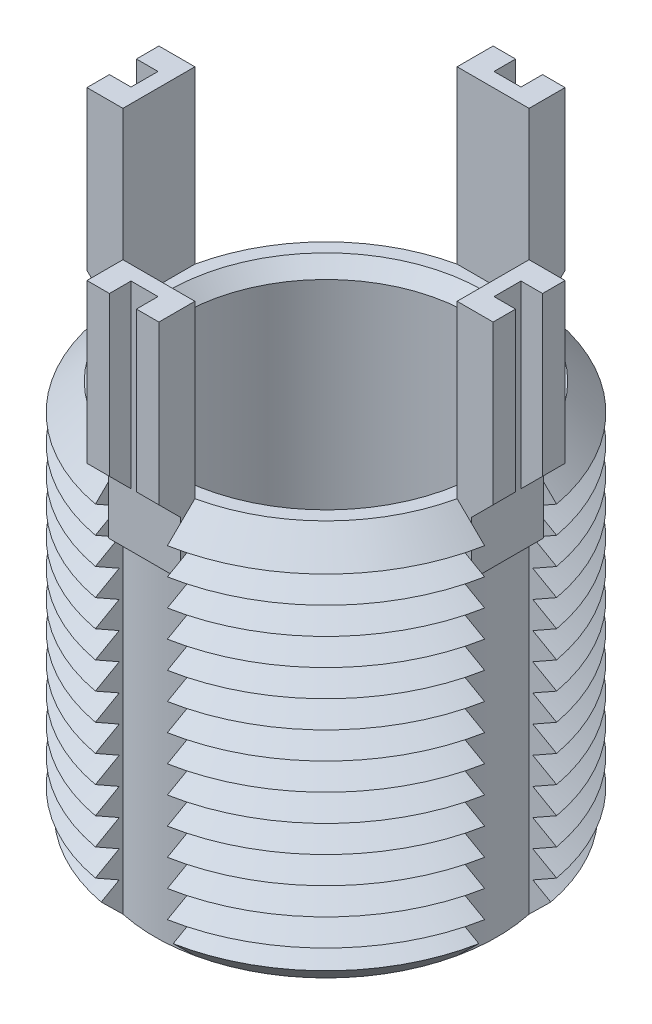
SolidWorks part; units mm, degrees
ref_plane "Front Plane" through (0, 0, 0) normal (0, 0, 1) x (1, 0, 0)
ref_plane "Top Plane" through (0, 0, 0) normal (0, 1, 0) x (1, 0, 0)
ref_plane "Right Plane" through (0, 0, 0) normal (1, 0, 0) x (0, 0, -1)
sketch "Sketch1" plane through (0, 0, 0) normal (0, 1, 0) x (1, 0, 0)
  circle A0 centre (0, 0) radius 11
  dimension "D1" = 22
extrude "Boss-Extrude1" add sketch "Sketch1" against normal blind 22
chamfer "Chamfer1" distance 1.5 angle 45 2 edges at (0, -22, 11) (0, 0, 11)
sketch "Sketch2" plane through (0, 0, 0) normal (1, 0, 0) x (0, 0, -1)
  line L0 (0, 0.8859) -> (0, -9.2617) construction
sketch "Sketch3" plane through (0, 0, 0) normal (1, 0, 0) x (0, 0, -1)
  line L0 (-11, -1.5) -> (-9.701, -2.25)
  line L1 (-9.701, -2.25) -> (-11, -3)
  line L2 (-11, -1.5) -> (-11, -20.5) construction
  line L3 (-11, -3) -> (-11, -1.5)
  dimension "D1" = 1.5
revolve "Cut-Revolve1" cut sketch "Sketch3" angle 360 about L0
pattern_linear "LPattern1" count 13 spacing 1.5 along (0, -1, 0) of "Cut-Revolve1"
sketch "Sketch4" plane through (0, 0, 0) normal (0, 1, 0) x (1, 0, 0)
  line L0 (-9.2871, 2) -> (-10.8167, 2)
  line L2 (-10.8167, -2) -> (-9.2871, -2)
  arc A0 (-9.2871, 2) -> (-9.2871, -2) centre (0, 0) ccw
  arc A1 (-10.8167, 2) -> (-10.8167, -2) centre (0, 0) ccw
  circle A2 centre (0, 0) radius 11 construction
  circle A3 centre (0, 0) radius 9.5 construction
  point P1 (-9.5, 0)
  point P3 (-11, 0)
  point P13 (0, 0)
  dimension "D1" = 4
extrude "Cut-Extrude1" cut sketch "Sketch4" against normal up to surface (22 mm away)
pattern_circular "CirPattern1" count 4 over 360 about axis through (0, 0, 0) along (0, 1, 0) of "Cut-Extrude1"
sketch "Sketch5" plane through (0, 0, 0) normal (1, 0, 0) x (0, 0, -1)
  line L0 (-9.2871, 9.5) -> (-9.2871, -3.5)
  line L1 (-9.2871, -3.5) -> (-10.0871, -3.5)
  line L2 (-10.0871, -3.5) -> (-10.0871, -0.5)
  line L3 (-10.0871, -0.5) -> (-11.2871, 0.7)
  line L4 (-11.2871, 0.7) -> (-11.2871, 9.5)
  line L5 (-11.2871, 9.5) -> (-9.2871, 9.5)
  line L6 (-10.8167, -4.5) -> (-2, -4.5) construction
  point P9 (-2, 0)
  point P10 (-10.0871, -0.5)
  dimension "D1" = 1
  dimension "D2" = 13
  dimension "D3" = 10
  dimension "D4" = 2
  dimension "D5" = 0.8
  dimension "D6" = 45
extrude "Boss-Extrude3" add sketch "Sketch5" along normal mid plane 4
pattern_circular "CirPattern2" count 4 over 360 about axis through (0, 0, 0) along (0, 1, 0) of "Boss-Extrude3"
sketch "Sketch6" plane through (0, 9.5, 0) normal (0, 1, 0) x (1, 0, 0)
  line L0 (-11.2871, -2) -> (-11.2871, 2) construction
  line L1 (-11.2871, -0.75) -> (-10.0871, -0.75)
  line L2 (-11.2871, -0.75) -> (-11.2871, 0.75)
  line L3 (-11.2871, 0.75) -> (-10.0871, 0.75)
  line L4 (-10.0871, -0.75) -> (-10.0871, 0.75)
  line L5 (-11.2871, -0.75) -> (-10.0871, 0.75) construction
  line L6 (-11.2871, 0.75) -> (-10.0871, -0.75) construction
  line L7 (11.2871, 2) -> (11.2871, -2) construction
  line L8 (-0.75, 10.0871) -> (0.75, 10.0871)
  line L9 (-0.75, 10.0871) -> (-0.75, 11.2871)
  line L10 (-0.75, 11.2871) -> (0.75, 11.2871)
  line L11 (0.75, 10.0871) -> (0.75, 11.2871)
  line L12 (-0.75, 10.0871) -> (0.75, 11.2871) construction
  line L13 (-0.75, 11.2871) -> (0.75, 10.0871) construction
  line L14 (10.0871, -0.75) -> (11.2871, -0.75)
  line L15 (10.0871, -0.75) -> (10.0871, 0.75)
  line L16 (10.0871, 0.75) -> (11.2871, 0.75)
  line L17 (11.2871, -0.75) -> (11.2871, 0.75)
  line L18 (10.0871, -0.75) -> (11.2871, 0.75) construction
  line L19 (10.0871, 0.75) -> (11.2871, -0.75) construction
  line L20 (-0.75, -11.2871) -> (0.75, -11.2871)
  line L21 (-0.75, -11.2871) -> (-0.75, -10.0871)
  line L22 (-0.75, -10.0871) -> (0.75, -10.0871)
  line L23 (0.75, -11.2871) -> (0.75, -10.0871)
  line L24 (-0.75, -11.2871) -> (0.75, -10.0871) construction
  line L25 (-0.75, -10.0871) -> (0.75, -11.2871) construction
  line L26 (-2, 11.2871) -> (2, 11.2871) construction
  line L27 (2, -11.2871) -> (-2, -11.2871) construction
  point P0 (-10.6871, 0)
  point P7 (-11.2871, 0)
  point P8 (-11.2871, 0)
  point P9 (0, 10.6871)
  point P14 (10.6871, 0)
  point P19 (0, -10.6871)
  point P24 (0, 11.2871)
  point P25 (11.2871, 0)
  point P26 (11.2871, 0)
  point P27 (0, 11.2871)
  point P30 (0, -11.2871)
  point P33 (0, -11.2871)
  dimension "D1" = 1.5
  dimension "D2" = 1.2
extrude "Cut-Extrude3" cut sketch "Sketch6" against normal through all both and the other way through all
sketch "Sketch7" plane through (0, 0, 0) normal (0, 1, 0) x (1, 0, 0)
  circle A0 centre (0, 0) radius 8
  dimension "D1" = 16
extrude "Cut-Extrude4" cut sketch "Sketch7" against normal up to surface (22 mm away)
chamfer "Chamfer2" distance 0.75 angle 45 2 edges at (0, 0, 8) (0, -22, 8)
